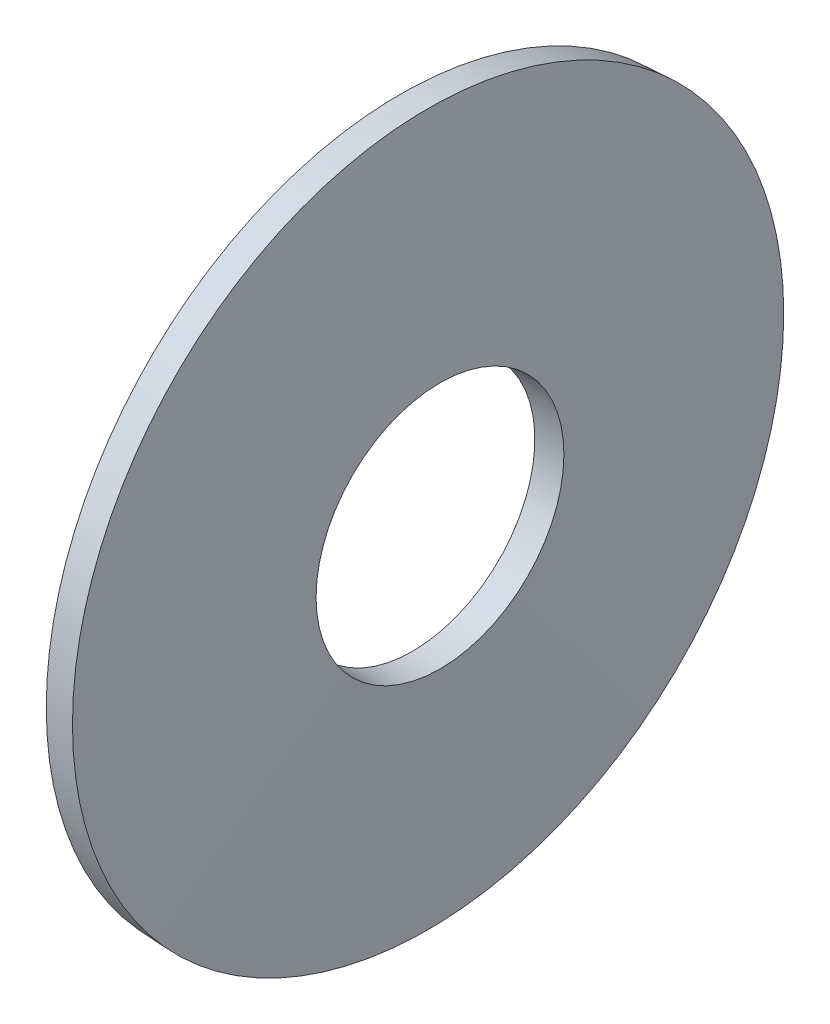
SolidWorks part; units mm, degrees
ref_plane "Plan1" through (0, 0, 0) normal (0, 0, 1) x (1, 0, 0)
ref_plane "Plan2" through (0, 0, 0) normal (0, 1, 0) x (1, 0, 0)
ref_plane "Plan3" through (0, 0, 0) normal (1, 0, 0) x (0, 0, -1)
sketch "Esquisse2" plane through (0, 0, 0) normal (0, 0, 1) x (1, 0, 0)
  line L0 (0, 8.9641) -> (0.3009, 3.1)
  line L1 (0.3009, 3.1) -> (1, 3.1359)
  line L2 (1, 3.1359) -> (0.6991, 9)
  line L3 (0.6991, 9) -> (0, 8.9641)
  line L4 (0, 0) -> (1, 0) construction
  dimension "de" = 9
  dimension "d" = 3.1
  dimension "e" = 0.7
  dimension "h" = 1
revolve "Base-Révolution" add sketch "Esquisse2" angle 360 about L4
